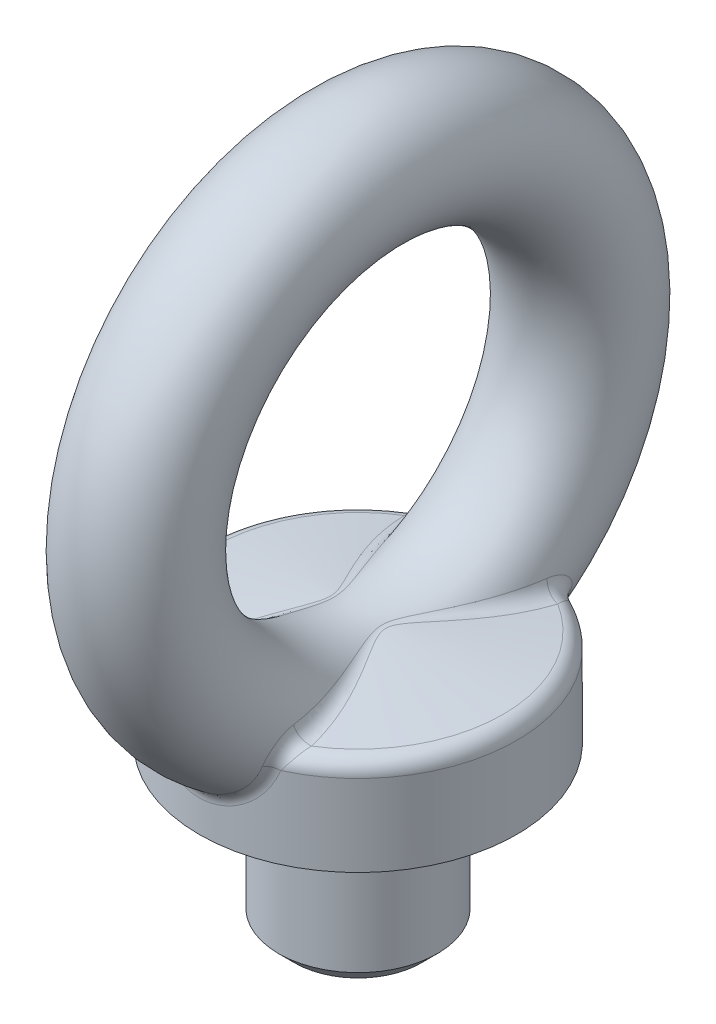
SolidWorks part; units mm, degrees
ref_plane "Plan de face" through (0, 0, 0) normal (0, 0, 1) x (1, 0, 0)
ref_plane "Plan de dessus" through (0, 0, 0) normal (0, 1, 0) x (1, 0, 0)
ref_plane "Plan de droite" through (0, 0, 0) normal (1, 0, 0) x (0, 0, -1)
sketch "Esquisse1" plane through (0, 0, 0) normal (0, 1, 0) x (1, 0, 0)
  line L0 (0, 0) -> (56.9609, 0) construction
  circle A0 centre (0, 28) radius 8
  dimension "D1" = 16
  dimension "D2" = 56
revolve "Révolution1" add sketch "Esquisse1" angle 360 about L0
sketch "Esquisse2" plane through (0, 0, 0) normal (0, 0, 1) x (1, 0, 0)
  line L0 (0, 0) -> (0, -80.3321) construction
  line L1 (0, -55) -> (8, -55)
  line L2 (10, -53) -> (10, -35)
  line L3 (10, -35) -> (20, -35)
  line L4 (20, -35) -> (20, -22.9911)
  line L5 (20, -22.9911) -> (0, -20.241)
  line L6 (0, -55) -> (0, -20.241)
  line L7 (8, -55) -> (10, -53)
  point P4 (10, -55)
  dimension "D1" = 35
  dimension "D2" = 20
  dimension "D3" = 10
  dimension "D4" = 40
  dimension "D5" = 2
  dimension "D6" = 45
revolve "Révolution2" add sketch "Esquisse2" angle 360 about L0
fillet "Congé1" radius 2 6 edges at (-0.6927, -29.9051, -19.988) (3.3008, -20.7031, -0.6313) (-3.3008, -20.7031, 0.6313) (0.6927, -29.9051, 19.988) (-20, -22.9911, 0) (20, -22.9911, 0)
